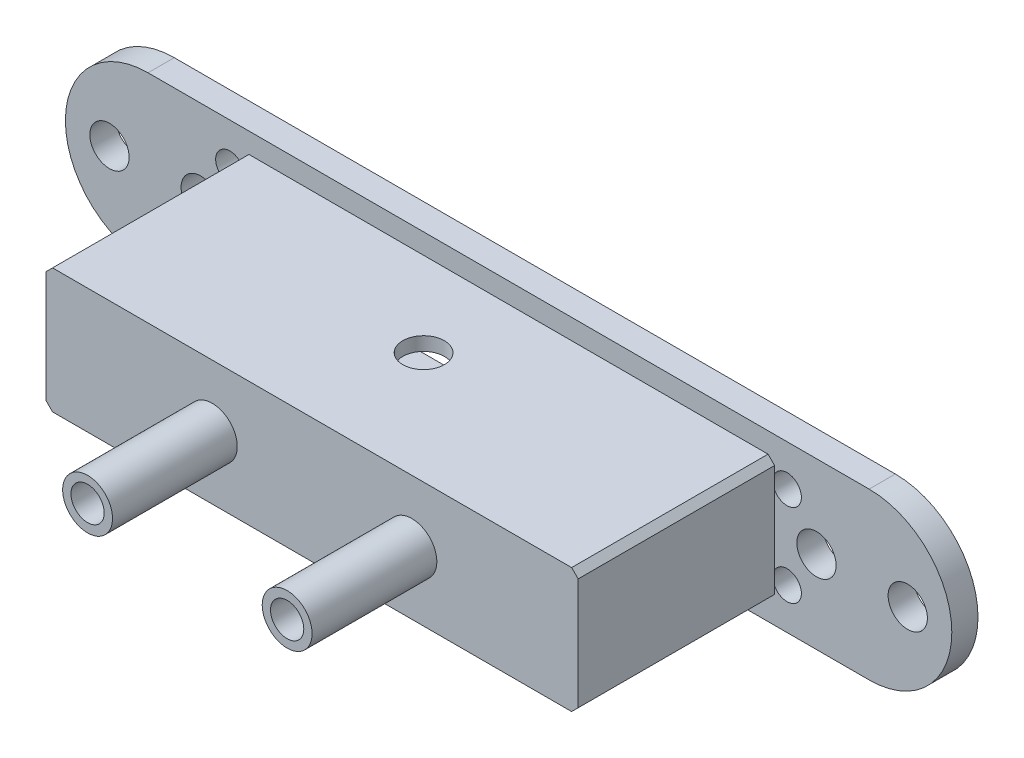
SolidWorks part; units mm, degrees
ref_plane "Front Plane" through (0, 0, 0) normal (0, 0, 1) x (1, 0, 0)
ref_plane "Top Plane" through (0, 0, 0) normal (0, 1, 0) x (1, 0, 0)
ref_plane "Right Plane" through (0, 0, 0) normal (1, 0, 0) x (0, 0, -1)
sketch "Sketch1" plane through (0, 0, 0) normal (0, 0, 1) x (1, 0, 0)
  circle A0 centre (-23.5059, 0) radius 1.5
  circle A1 centre (23.5204, 0) radius 1.5
  line B0 (-27.5264, 6.3119) -> (27.5408, 6.3119)
  line B1 (-20.3128, 4.7625) -> (20.3272, 4.7625)
  line B2 (-20.3128, 4.7625) -> (-20.3128, -4.7625)
  line B3 (-20.3128, -4.7625) -> (20.3272, -4.7625)
  line B4 (20.3272, 4.7625) -> (20.3272, -4.7625)
  line B5 (-27.5264, -6.3119) -> (27.5408, -6.3119)
  circle B6 centre (-13.4928, 0) radius 2
  circle B7 centre (-4.4928, 0) radius 2
  circle B8 centre (4.5072, 0) radius 2
  circle B9 centre (13.5072, 0) radius 2
  circle B10 centre (-30.4728, 0) radius 1.5
  circle B11 centre (-23.5059, 0) radius 1.5 construction
  circle B12 centre (23.5204, 0) radius 1.5 construction
  circle B13 centre (30.4872, 0) radius 1.5
  arc B14 (-27.5264, 6.3119) -> (-27.5264, -6.3119) centre (-27.5264, 0) ccw
  arc B15 (27.5408, 6.3119) -> (27.5408, -6.3119) centre (27.5408, 0) cw
sketch_block_instance "Block2-1"
sketch_block "Block2"
sketch_block_instance "Block1-1"
sketch_block "Block1" parameters "D1"=6.5867
extrude "Extrude1" add sketch "Sketch1" along normal blind 2
sketch "Sketch2" plane through (0, 0, 2) normal (0, 0, 1) x (1, 0, 0)
  line L0 (-13.5, 0) -> (13.5, 0)
  circle A0 centre (-8.9422, 0) radius 2.0016
  circle A1 centre (9.0212, 0) radius 2.0016
  line B0 (-27.5336, 6.3119) -> (27.5336, 6.3119)
  line B1 (-20.32, 4.7625) -> (20.32, 4.7625)
  line B2 (-20.32, 4.7625) -> (-20.32, -4.7625)
  line B3 (-20.32, -4.7625) -> (20.32, -4.7625)
  line B4 (20.32, 4.7625) -> (20.32, -4.7625)
  line B5 (-27.5336, -6.3119) -> (27.5336, -6.3119)
  circle B6 centre (-13.5, 0) radius 2
  circle B7 centre (-4.5, 0) radius 2
  circle B8 centre (4.5, 0) radius 2
  circle B9 centre (13.5, 0) radius 2
  circle B10 centre (-30.48, 0) radius 1.5
  circle B11 centre (-23.5132, 0) radius 1.5 construction
  circle B12 centre (23.5132, 0) radius 1.5 construction
  circle B13 centre (30.48, 0) radius 1.5
  arc B14 (-27.5336, 6.3119) -> (-27.5336, -6.3119) centre (-27.5336, 0) ccw
  arc B15 (27.5336, 6.3119) -> (27.5336, -6.3119) centre (27.5336, 0) cw
sketch_block_instance "Block2-2"
extrude "Extrude2" add sketch "Sketch2" along normal blind 15 contours B1 B4 B3 B2
chamfer "Chamfer1" distance 0.5 angle 45 1 edges at (-20.32, 4.7625, 9.5)
chamfer "Chamfer2" distance 0.5 angle 45 1 edges at (20.32, 4.7625, 9.5)
chamfer "Chamfer3" distance 0.5 angle 45 1 edges at (20.32, -4.7625, 9.5)
chamfer "Chamfer4" distance 0.5 angle 45 1 edges at (-20.32, -4.7625, 9.5)
shell "Shell10" thickness 1.0414
sketch "Sketch13" plane through (0, 0, 17) normal (0, 0, 1) x (1, 0, 0)
  circle A0 centre (-7.62, 0) radius 1.905
  circle A1 centre (7.62, 0) radius 1.905
extrude "Extrude10" add sketch "Sketch13" along normal blind 9.525 contours A1 | A0
sketch "Sketch15" plane through (0, 0, 26.525) normal (0, 0, 1) x (1, 0, 0)
  circle A0 centre (-7.62, 0.047) radius 1.27
  circle A1 centre (7.62, -0.0103) radius 1.27
extrude "Extrude11" cut sketch "Sketch15" against normal through all
sketch "Sketch16" plane through (0, 4.7625, 0) normal (0, 1, 0) x (-1, 0, 0)
  circle A0 centre (0.0457, 8.4409) radius 1.5875
extrude "Extrude12" cut sketch "Sketch16" against normal up to next
hole_wizard "#2-56 Tapped Hole1" positions "3DSketch1" profile "Sketch17" tap size "#2-56" standard "Ansi Inch"
sketch3d "3DSketch1"
  point P0 (-21.2725, 3.175, 2)
  point P2 (-21.2725, -3.175, 2)
  point P4 (21.2725, 3.175, 2)
  point P6 (21.2725, -3.175, 2)
sketch "Sketch17" plane through (-21.2725, 3.175, 2) normal (1, 0, 0) x (0, -1, 0)
  line L0 (0, 0) -> (0, 2)
  line L1 (0, 2) -> (1.0922, 2)
  line L2 (1.0922, 2) -> (1.0922, 0)
  line L5 (1.0922, 0) -> (0, 0)
  line L11 (0, -6.35) -> (0, 107.95) construction
  dimension "Thread Major Dia." = 2.1844
  dimension "Thru Tap Drill Depth" = 2
